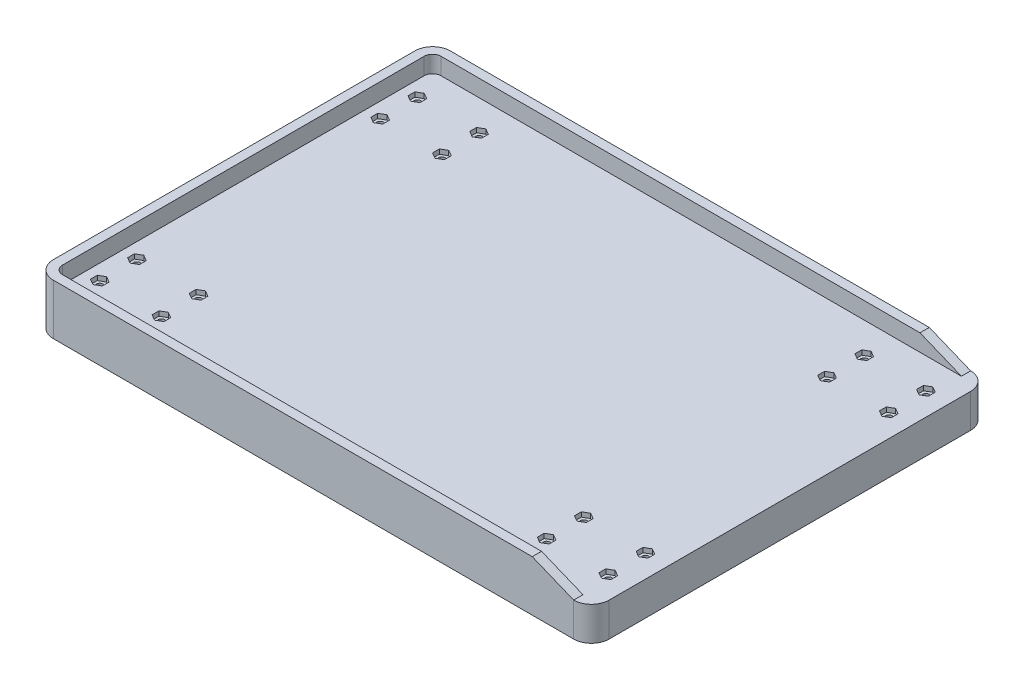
SolidWorks part; units mm, degrees
ref_plane "前基準面" through (0, 0, 0) normal (0, 0, 1) x (1, 0, 0)
ref_plane "上基準面" through (0, 0, 0) normal (0, 1, 0) x (1, 0, 0)
ref_plane "右基準面" through (0, 0, 0) normal (1, 0, 0) x (0, 0, -1)
sketch "草圖1" plane through (0, 0, 0) normal (0, 1, 0) x (1, 0, 0)
  line L0 (0, 0) -> (-329, 0) construction
  line L1 (-308, 235) -> (308, 235)
  line L2 (-329, 214) -> (-329, -214)
  line L3 (-308, -235) -> (308, -235)
  line L4 (329, 214) -> (329, -214)
  line L5 (0, 0) -> (0, 235) construction
  arc A0 (-329, -214) -> (-308, -235) centre (-308, -214) ccw
  arc A1 (-308, 235) -> (-329, 214) centre (-308, 214) ccw
  arc A2 (308, -235) -> (329, -214) centre (308, -214) ccw
  arc A3 (308, 235) -> (329, 214) centre (308, 214) cw
  point P10 (-329, -235)
  point P13 (-329, 235)
  point P18 (329, 235)
  dimension "D3" = 21
  dimension "D4" = 21
  dimension "D1" = 658
  dimension "D2" = 470
extrude "填料-伸長1" add sketch "草圖1" along normal blind 60
sketch "草圖2" plane through (0, 60, 0) normal (0, 1, 0) x (1, 0, 0)
  line L13 (308, 224) -> (352.2664, 224)
  line L14 (352.2664, 224) -> (352.2664, -224)
  line L15 (352.2664, -224) -> (308, -224)
  line L16 (-308, -224) -> (308, -224)
  line L17 (-318, 214) -> (-318, -214)
  line L18 (308, 224) -> (-308, 224)
  line L19 (-308, -224) -> (308, -224)
  line L20 (-318, 214) -> (-318, -214)
  line L21 (308, 224) -> (-308, 224)
  arc A12 (-318, -214) -> (-308, -224) centre (-308, -214) ccw
  arc A13 (-308, 224) -> (-318, 214) centre (-308, 214) ccw
  arc A14 (-318, -214) -> (-308, -224) centre (-308, -214) ccw
  arc A15 (-308, 224) -> (-318, 214) centre (-308, 214) ccw
  dimension "D1" = 11
extrude "除料-伸長1" cut sketch "草圖2" against normal blind 20
sketch "草圖3" plane through (0, 0, 0) normal (0, 0, 1) x (1, 0, 0)
  line L0 (308, 40) -> (259, 60)
  line L1 (308, 60) -> (308, 0) construction
  line L2 (-308, 60) -> (308, 60) construction
  line L3 (329, 40) -> (329, 0) construction
  line L4 (329, 40) -> (326.4662, 40) construction
  line L5 (308, 40) -> (362.1574, 40)
  line L6 (362.1574, 40) -> (362.1574, 75.4034)
  line L7 (362.1574, 75.4034) -> (259, 75.4034)
  line L8 (259, 75.4034) -> (259, 60)
  dimension "D1" = 70
extrude "除料-伸長2" cut sketch "草圖3" against normal mid plane 600
sketch "草圖4" plane through (0, 0, 0) normal (0, 1, 0) x (1, 0, 0)
  line L0 (0, 0) -> (-329, 0) construction
  line L1 (0, 0) -> (0, 235) construction
  line B0 (304, 235) -> (-304, 235)
  line B1 (-329, 210) -> (-329, -210)
  circle B2 centre (-300, 188) radius 4
  circle B3 centre (-227, 188) radius 4
  circle B4 centre (-227, 144) radius 4
  circle B5 centre (-300, 144) radius 4
  circle B6 centre (-300, -144) radius 4
  circle B7 centre (-227, -144) radius 4
  circle B8 centre (-227, -188) radius 4
  circle B9 centre (-300, -188) radius 4
  circle B10 centre (229, -188) radius 4
  circle B11 centre (302, -188) radius 4
  circle B12 centre (302, -144) radius 4
  circle B13 centre (229, -144) radius 4
  circle B14 centre (229, 144) radius 4
  circle B15 centre (229, 188) radius 4
  circle B16 centre (302, 188) radius 4
  circle B17 centre (302, 144) radius 4
sketch_block_instance "A$C21CC0B6B-1"
sketch_block "A$C21CC0B6B"
sketch "草圖6" plane through (0, 40, 0) normal (0, 1, 0) x (1, 0, 0)
  line L0 (309, 148.0415) -> (302, 152.0829)
  line L1 (309, 183.9585) -> (309, 192.0415)
  line L2 (309, 192.0415) -> (302, 196.0829)
  line L3 (302, 196.0829) -> (295, 192.0415)
  line L4 (295, 192.0415) -> (295, 183.9585)
  line L5 (295, 183.9585) -> (302, 179.9171)
  line L6 (302, 179.9171) -> (309, 183.9585)
  line L7 (302, 152.0829) -> (295, 148.0415)
  line L8 (302, 135.9171) -> (309, 139.9585)
  line L9 (295, 139.9585) -> (302, 135.9171)
  line L10 (295, 148.0415) -> (295, 139.9585)
  line L11 (309, 139.9585) -> (309, 148.0415)
  line L12 (236, 148.0415) -> (229, 152.0829)
  line L13 (229, 152.0829) -> (222, 148.0415)
  line L14 (229, 135.9171) -> (236, 139.9585)
  line L15 (222, 139.9585) -> (229, 135.9171)
  line L16 (222, 148.0415) -> (222, 139.9585)
  line L17 (236, 139.9585) -> (236, 148.0415)
  line L18 (236, 192.0415) -> (229, 196.0829)
  line L19 (229, 196.0829) -> (222, 192.0415)
  line L20 (229, 179.9171) -> (236, 183.9585)
  line L21 (222, 183.9585) -> (229, 179.9171)
  line L22 (222, 192.0415) -> (222, 183.9585)
  line L23 (236, 183.9585) -> (236, 192.0415)
  line L24 (-220, 192.0415) -> (-227, 196.0829)
  line L25 (-227, 196.0829) -> (-234, 192.0415)
  line L26 (-227, 179.9171) -> (-220, 183.9585)
  line L27 (-234, 183.9585) -> (-227, 179.9171)
  line L28 (-234, 192.0415) -> (-234, 183.9585)
  line L29 (-220, 183.9585) -> (-220, 192.0415)
  line L30 (-293, 192.0415) -> (-300, 196.0829)
  line L31 (-300, 196.0829) -> (-307, 192.0415)
  line L32 (-300, 179.9171) -> (-293, 183.9585)
  line L33 (-307, 183.9585) -> (-300, 179.9171)
  line L34 (-307, 192.0415) -> (-307, 183.9585)
  line L35 (-293, 183.9585) -> (-293, 192.0415)
  line L36 (-293, 148.0415) -> (-300, 152.0829)
  line L37 (-300, 152.0829) -> (-307, 148.0415)
  line L38 (-300, 135.9171) -> (-293, 139.9585)
  line L39 (-307, 139.9585) -> (-300, 135.9171)
  line L40 (-307, 148.0415) -> (-307, 139.9585)
  line L41 (-293, 139.9585) -> (-293, 148.0415)
  line L42 (-220, 148.0415) -> (-227, 152.0829)
  line L43 (-227, 152.0829) -> (-234, 148.0415)
  line L44 (-227, 135.9171) -> (-220, 139.9585)
  line L45 (-234, 139.9585) -> (-227, 135.9171)
  line L46 (-234, 148.0415) -> (-234, 139.9585)
  line L47 (-220, 139.9585) -> (-220, 148.0415)
  line L48 (-293, -139.9585) -> (-300, -135.9171)
  line L49 (-300, -135.9171) -> (-307, -139.9585)
  line L50 (-300, -152.0829) -> (-293, -148.0415)
  line L51 (-307, -148.0415) -> (-300, -152.0829)
  line L52 (-307, -139.9585) -> (-307, -148.0415)
  line L53 (-293, -148.0415) -> (-293, -139.9585)
  line L54 (-220, -139.9585) -> (-227, -135.9171)
  line L55 (-227, -135.9171) -> (-234, -139.9585)
  line L56 (-227, -152.0829) -> (-220, -148.0415)
  line L57 (-234, -148.0415) -> (-227, -152.0829)
  line L58 (-234, -139.9585) -> (-234, -148.0415)
  line L59 (-220, -148.0415) -> (-220, -139.9585)
  line L60 (-293, -183.9585) -> (-300, -179.9171)
  line L61 (-300, -179.9171) -> (-307, -183.9585)
  line L62 (-300, -196.0829) -> (-293, -192.0415)
  line L63 (-307, -192.0415) -> (-300, -196.0829)
  line L64 (-307, -183.9585) -> (-307, -192.0415)
  line L65 (-293, -192.0415) -> (-293, -183.9585)
  line L66 (-220, -183.9585) -> (-227, -179.9171)
  line L67 (-227, -179.9171) -> (-234, -183.9585)
  line L68 (-227, -196.0829) -> (-220, -192.0415)
  line L69 (-234, -192.0415) -> (-227, -196.0829)
  line L70 (-234, -183.9585) -> (-234, -192.0415)
  line L71 (-220, -192.0415) -> (-220, -183.9585)
  line L72 (236, -139.9585) -> (229, -135.9171)
  line L73 (229, -135.9171) -> (222, -139.9585)
  line L74 (229, -152.0829) -> (236, -148.0415)
  line L75 (222, -148.0415) -> (229, -152.0829)
  line L76 (222, -139.9585) -> (222, -148.0415)
  line L77 (236, -148.0415) -> (236, -139.9585)
  line L78 (236, -183.9585) -> (229, -179.9171)
  line L79 (229, -179.9171) -> (222, -183.9585)
  line L80 (229, -196.0829) -> (236, -192.0415)
  line L81 (222, -192.0415) -> (229, -196.0829)
  line L82 (222, -183.9585) -> (222, -192.0415)
  line L83 (236, -192.0415) -> (236, -183.9585)
  line L84 (309, -139.9585) -> (302, -135.9171)
  line L85 (302, -135.9171) -> (295, -139.9585)
  line L86 (302, -152.0829) -> (309, -148.0415)
  line L87 (295, -148.0415) -> (302, -152.0829)
  line L88 (295, -139.9585) -> (295, -148.0415)
  line L89 (309, -148.0415) -> (309, -139.9585)
  line L90 (309, -183.9585) -> (302, -179.9171)
  line L91 (302, -179.9171) -> (295, -183.9585)
  line L92 (302, -196.0829) -> (309, -192.0415)
  line L93 (295, -192.0415) -> (302, -196.0829)
  line L94 (295, -183.9585) -> (295, -192.0415)
  line L95 (309, -192.0415) -> (309, -183.9585)
  circle A0 centre (302, 188) radius 7 construction
  dimension "D1" = 14
extrude "除料-伸長3" cut sketch "草圖6" against normal blind 5.5
sketch "草圖7" plane through (0, 40, 0) normal (0, 1, 0) x (1, 0, 0)
  circle A0 centre (-300, 188) radius 4 construction
  circle A1 centre (-300, 144) radius 4 construction
  circle A2 centre (-227, 144) radius 4 construction
  circle A3 centre (-227, 188) radius 4 construction
  circle A4 centre (-300, 188) radius 4
  circle A5 centre (-300, 144) radius 4
  circle A6 centre (-227, 144) radius 4
  circle A7 centre (-227, 188) radius 4
  circle A8 centre (-300, -144) radius 4 construction
  circle A9 centre (-300, -188) radius 4 construction
  circle A10 centre (-227, -188) radius 4 construction
  circle A11 centre (-227, -144) radius 4 construction
  circle A12 centre (-300, -144) radius 4
  circle A13 centre (-300, -188) radius 4
  circle A14 centre (-227, -188) radius 4
  circle A15 centre (-227, -144) radius 4
  circle A16 centre (229, -144) radius 4 construction
  circle A17 centre (229, -188) radius 4 construction
  circle A18 centre (302, -188) radius 4 construction
  circle A19 centre (302, -144) radius 4 construction
  circle A20 centre (229, 188) radius 4 construction
  circle A21 centre (229, 144) radius 4 construction
  circle A22 centre (302, 144) radius 4 construction
  circle A23 centre (302, 188) radius 4 construction
  circle A24 centre (229, -144) radius 4
  circle A25 centre (229, -188) radius 4
  circle A26 centre (302, -188) radius 4
  circle A27 centre (302, -144) radius 4
  circle A28 centre (229, 188) radius 4
  circle A29 centre (229, 144) radius 4
  circle A30 centre (302, 144) radius 4
  circle A31 centre (302, 188) radius 4
extrude "除料-伸長4" cut sketch "草圖7" against normal up to vertex (40 mm away)
sketch "草圖8" plane through (0, 0, 0) normal (0, -1, 0) x (1, 0, 0)
  line L0 (-300, 188) -> (-227, 144) construction
  line L1 (-227, 188) -> (-300, 144) construction
  line L2 (-300, -144) -> (-227, -188) construction
  line L3 (-227, -144) -> (-300, -188) construction
  line L4 (229, -144) -> (302, -188) construction
  line L5 (229, -188) -> (302, -144) construction
  line L6 (229, 188) -> (302, 144) construction
  line L7 (302, 188) -> (229, 144) construction
  circle A0 centre (-263.5, 166) radius 2
  circle A1 centre (-263.5, -166) radius 2
  circle A2 centre (265.5, -166) radius 2
  circle A3 centre (265.5, 166) radius 2
  point P8 (-263.5, 166)
  point P19 (-263.5, -166)
  point P30 (265.5, -166)
  point P41 (265.5, 166)
extrude "填料-伸長2" add sketch "草圖8" along normal blind 0.1
